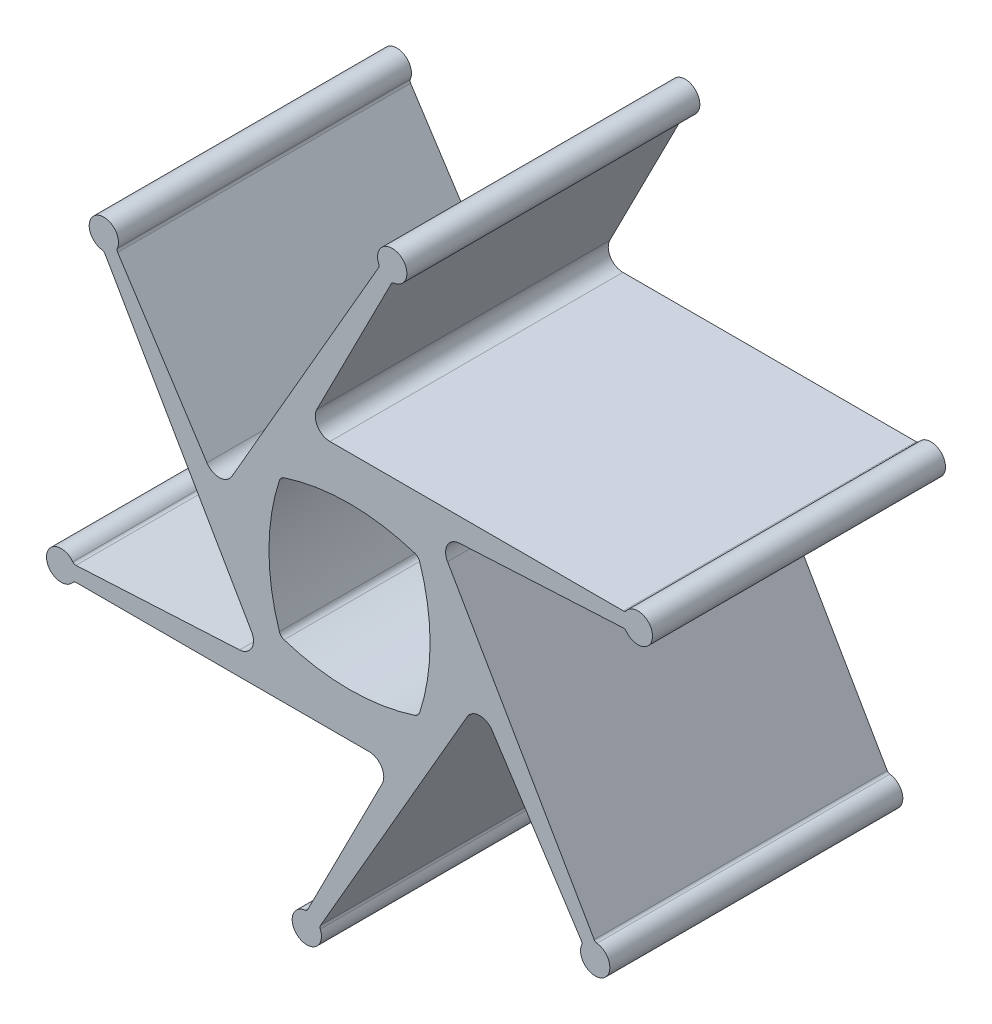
SolidWorks part; units mm, degrees
ref_plane "Plan de face" through (0, 0, 0) normal (0, 0, 1) x (1, 0, 0)
ref_plane "Plan de dessus" through (0, 0, 0) normal (0, 1, 0) x (1, 0, 0)
ref_plane "Plan de droite" through (0, 0, 0) normal (1, 0, 0) x (0, 0, -1)
sketch "Esquisse1" plane through (0, 0, 0) normal (0, 0, 1) x (1, 0, 0)
  line L0 (-16.2664, 6.1832) -> (3.7578, 40.8662)
  line L1 (-37.5641, -14.9851) -> (-15.2186, -13.8141)
  line L2 (-13.5912, -10.8168) -> (-33.6154, 23.8662)
  line L3 (-31.8627, 24.8602) -> (-19.6758, 6.0939)
  line L4 (2.4689, -17) -> (-37.5796, -17)
  line L5 (5.495, 39.8453) -> (-4.6636, 19.908)
  line L6 (-2.8816, 17) -> (37.1669, 17)
  line L7 (37.1514, 14.9851) -> (14.8058, 13.8141)
  line L8 (13.1785, 10.8168) -> (33.2027, -23.8662)
  line L9 (31.45, -24.8602) -> (19.2631, -6.0939)
  line L10 (15.8537, -6.1832) -> (-4.1705, -40.8662)
  line L11 (-5.9077, -39.8453) -> (4.2509, -19.908)
  arc A0 (4.2509, -19.908) -> (2.4689, -17) centre (2.4689, -19) ccw
  arc A1 (-37.5796, -17) -> (-37.9796, -17.2) centre (-37.5796, -17.5) ccw
  arc A2 (-37.9881, -14.7887) -> (-37.5641, -14.9851) centre (-37.5903, -14.4858) ccw
  arc A3 (-33.6154, 23.8662) -> (-33.9886, 24.1126) centre (-34.0484, 23.6162) ccw
  arc A4 (-31.9046, 25.3256) -> (-31.8627, 24.8602) centre (-31.4434, 25.1325) ccw
  arc A5 (-37.9881, -14.7887) -> (-37.9796, -17.2) centre (-39.5796, -16) ccw
  arc A6 (-15.2186, -13.8141) -> (-13.5912, -10.8168) centre (-15.3232, -11.8168) ccw
  arc A7 (-31.9046, 25.3256) -> (-33.9886, 24.1126) centre (-33.7494, 26.0982) ccw
  arc A8 (-19.6758, 6.0939) -> (-16.2664, 6.1832) centre (-17.9984, 7.1832) ccw
  arc A9 (5.8772, 40.1143) -> (5.495, 39.8453) centre (5.9405, 39.6183) ccw
  arc A10 (3.7578, 40.8662) -> (3.7846, 41.3126) centre (3.3248, 41.1162) ccw
  arc A11 (5.8772, 40.1143) -> (3.7846, 41.3126) centre (5.6238, 42.0982) ccw
  arc A12 (37.5754, 14.7887) -> (37.1514, 14.9851) centre (37.1776, 14.4858) ccw
  arc A13 (37.1669, 17) -> (37.5669, 17.2) centre (37.1669, 17.5) ccw
  arc A14 (37.5754, 14.7887) -> (37.5669, 17.2) centre (39.1669, 16) ccw
  arc A15 (33.2027, -23.8662) -> (33.5759, -24.1126) centre (33.6357, -23.6162) ccw
  arc A16 (31.4919, -25.3256) -> (31.45, -24.8602) centre (31.0307, -25.1325) ccw
  arc A17 (-4.1705, -40.8662) -> (-4.1973, -41.3126) centre (-3.7375, -41.1162) ccw
  arc A18 (-6.2899, -40.1143) -> (-5.9077, -39.8453) centre (-6.3532, -39.6183) ccw
  arc A19 (19.2631, -6.0939) -> (15.8537, -6.1832) centre (17.5857, -7.1832) ccw
  arc A20 (14.8058, 13.8141) -> (13.1785, 10.8168) centre (14.9105, 11.8168) ccw
  arc A21 (-4.6636, 19.908) -> (-2.8816, 17) centre (-2.8816, 19) ccw
  arc A22 (31.4919, -25.3256) -> (33.5759, -24.1126) centre (33.3367, -26.0982) ccw
  arc A23 (-6.2899, -40.1143) -> (-4.1973, -41.3126) centre (-6.0366, -42.0982) ccw
  arc A24 (9.3696, 8.9363) -> (8.7299, 9.5759) centre (8.4191, 8.6254) ccw
  arc A25 (8.7299, -9.5759) -> (9.3696, -8.9363) centre (8.4191, -8.6254) ccw
  arc A26 (-9.7823, -8.9363) -> (-9.1426, -9.5759) centre (-8.8318, -8.6254) ccw
  arc A27 (-9.1426, 9.5759) -> (-9.7823, 8.9363) centre (-8.8318, 8.6254) ccw
  arc A28 (-9.1426, -9.5759) -> (8.7299, -9.5759) centre (-0.2064, 17.75) ccw
  arc A29 (9.3696, -8.9363) -> (9.3696, 8.9363) centre (-17.9564, 0) ccw
  arc A30 (8.7299, 9.5759) -> (-9.1426, 9.5759) centre (-0.2064, -17.75) ccw
  arc A31 (-9.7823, 8.9363) -> (-9.7823, -8.9363) centre (17.5436, 0) ccw
extrude "Extrusion1" add sketch "Esquisse1" along normal blind 40
